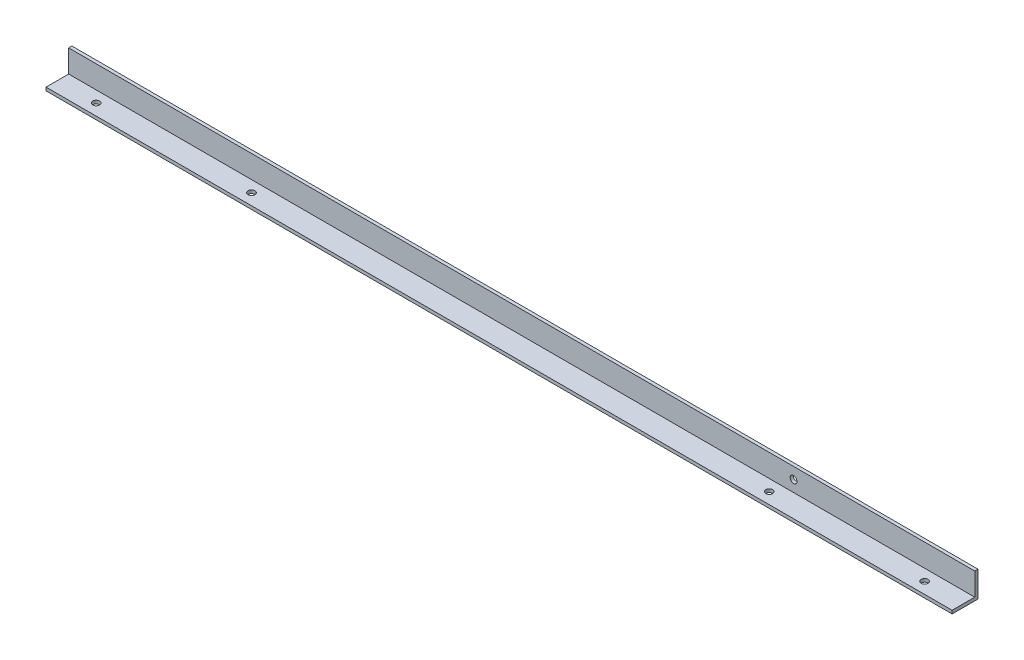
SolidWorks part; units mm, degrees
ref_plane "Front Plane" through (0, 0, 0) normal (0, 0, 1) x (1, 0, 0)
ref_plane "Top Plane" through (0, 0, 0) normal (0, 1, 0) x (1, 0, 0)
ref_plane "Right Plane" through (0, 0, 0) normal (1, 0, 0) x (0, 0, -1)
sketch "Sketch1" plane through (0, 0, 0) normal (0, 1, 0) x (1, 0, 0)
  line L1 (-444.5, 12.7) -> (444.5, 12.7)
  line L2 (-444.5, 12.7) -> (-444.5, -12.7)
  line L3 (-444.5, -12.7) -> (444.5, -12.7)
  line L4 (444.5, 12.7) -> (444.5, -12.7)
  line L5 (-444.5, 12.7) -> (444.5, -12.7) construction
  line L6 (-444.5, -12.7) -> (444.5, 12.7) construction
  point P0 (0, 0)
  dimension "D1" = 889
  dimension "D2" = 25.4
extrude "Boss-Extrude1" add sketch "Sketch1" along normal blind 3.175
sketch "Sketch2" plane through (0, 3.175, 0) normal (0, 1, 0) x (1, 0, 0)
  line L0 (-444.5, 12.7) -> (-444.5, 9.525)
  line L1 (-444.5, 12.7) -> (-444.5, -12.7) construction
  line L2 (-444.5, 9.525) -> (444.5, 9.525)
  line L3 (444.5, -12.7) -> (444.5, 12.7) construction
  line L4 (444.5, 9.525) -> (444.5, 12.7)
  line L5 (444.5, 12.7) -> (-444.5, 12.7)
  dimension "D1" = 3.175
extrude "Boss-Extrude2" add sketch "Sketch2" along normal blind 22.225
sketch "Sketch3" plane through (0, 3.175, 0) normal (0, 1, 0) x (1, 0, 0)
  line L0 (-444.5, -1.5875) -> (444.5, -1.5875) construction
  line L1 (-444.5, 9.525) -> (-444.5, -12.7) construction
  line L2 (444.5, -12.7) -> (444.5, 9.525) construction
  line L3 (-444.5, -12.7) -> (444.5, -12.7) construction
  circle A0 centre (-406.4, -1.5875) radius 3.3782
  circle A1 centre (-254, -1.5875) radius 3.3782
  circle A2 centre (406.4, -1.5875) radius 3.3782
  circle A3 centre (254, -1.5875) radius 3.3782
  dimension "D2" = 6.7564
  dimension "D3" = 6.7564
  dimension "D4" = 6.7564
  dimension "D5" = 6.7564
  dimension "D1" = 11.1125
  dimension "D6" = 38.1
  dimension "D7" = 152.4
  dimension "D8" = 38.1
  dimension "D9" = 152.4
extrude "Cut-Extrude1" cut sketch "Sketch3" against normal through all
sketch "Sketch4" plane through (0, 0, -9.525) normal (0, 0, 1) x (1, 0, 0)
  line L0 (-444.5, 14.2875) -> (444.5, 14.2875) construction
  line L1 (-444.5, 25.4) -> (-444.5, 3.175) construction
  line L2 (444.5, 25.4) -> (444.5, 3.175) construction
  line L3 (-444.5, 25.4) -> (444.5, 25.4) construction
  circle A0 centre (266.7, 14.2875) radius 3.3782
  dimension "D2" = 6.7564
  dimension "D1" = 11.1125
  dimension "D3" = 177.8
extrude "Cut-Extrude2" cut sketch "Sketch4" against normal through all
